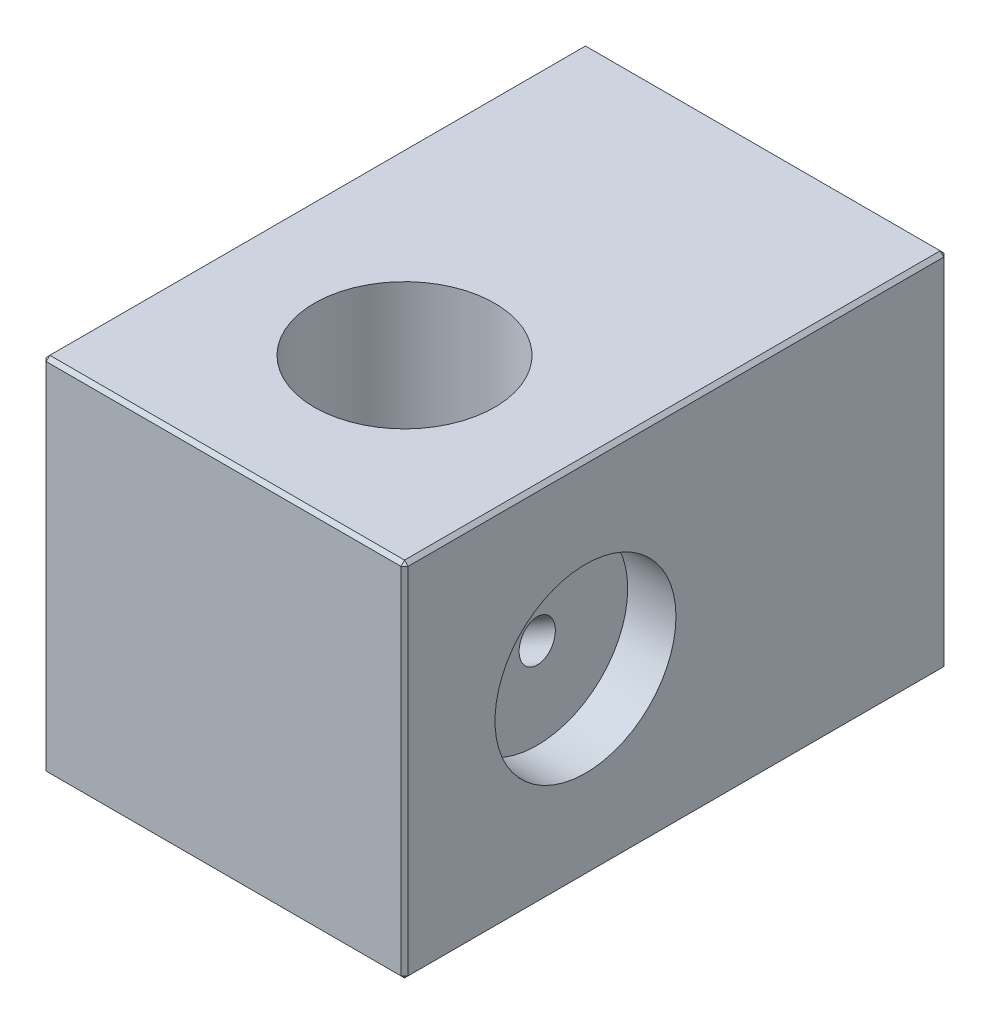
SolidWorks part; units mm, degrees
ref_plane "Přední rovina" through (0, 0, 0) normal (0, 0, 1) x (1, 0, 0)
ref_plane "Horní rovina" through (0, 0, 0) normal (0, 1, 0) x (1, 0, 0)
ref_plane "Pravá rovina" through (0, 0, 0) normal (1, 0, 0) x (0, 0, -1)
sketch "Skica1" plane through (0, 0, 0) normal (0, 1, 0) x (1, 0, 0)
  line L1 (-15, 0) -> (15, 0)
  line L2 (-15, 0) -> (-15, 45)
  line L3 (-15, 45) -> (15, 45)
  line L4 (15, 0) -> (15, 45)
  dimension "D1" = 30
  dimension "D2" = 45
  dimension "D3" = 15
extrude "Přidat vysunutím1" add sketch "Skica1" along normal blind 30
chamfer "Zkosení1" distance 0.3 angle 45 12 edges at (15, 15, 0) (-15, 15, 0) (0, 0, 0) (-15, 0, -22.5) (-15, 15, -45) (0, 0, -45) (15, 0, -22.5) (15, 15, -45) (0, 30, -45) (-15, 30, -22.5) (15, 30, -22.5) (0, 30, 0)
sketch "Skica2" plane through (0, 30, 0) normal (0, 1, 0) x (1, 0, 0)
  line L0 (14.7, 0) -> (-14.7, 0) construction
  circle A0 centre (0, 15) radius 7.475
  point P2 (0, 0)
  dimension "D1" = 14.95
  dimension "D2" = 15
extrude "Odebrat vysunutím1" cut sketch "Skica2" against normal blind 12
sketch "Skica3" plane through (0, 18, 0) normal (0, 1, 0) x (1, 0, 0)
  circle A0 centre (0, 15) radius 6.25
  circle A1 centre (0, 15) radius 7.475 construction
  dimension "D1" = 12.5
  dimension "D2" = 0
extrude "Odebrat vysunutím2" cut sketch "Skica3" against normal blind 3
hole_wizard "Ø3.5 (3.5) průměr díry1" positions "Skica5" profile "Skica4" hole size "Ø3.5" standard "ISO"
sketch "Skica5" plane through (0, 15, 0) normal (0, 1, 0) x (-1, 0, 0)
  circle A0 centre (0, -15) radius 6.25 construction
  point P0 (0, -15)
  dimension "D1" = 0
sketch "Skica4" plane through (0, 15, -15) normal (1, 0, 0) x (0, 0, 1)
  line L0 (0, 0) -> (0, 11.0104)
  line L1 (0, 11.0104) -> (1.75, 10)
  line L2 (1.75, 10) -> (1.75, 0)
  line L5 (1.75, 0) -> (0, 0)
  line L10 (0, 11.0104) -> (-1.75, 10) construction
  line L11 (0, -6.35) -> (0, 107.95) construction
  dimension "Průměr díry" = 3.5
  dimension "Hloubka díry" = 10
  dimension "Úhel vrtání" = 120
sketch "Skica6" plane through (15, 0, 0) normal (1, 0, 0) x (0, 0, -1)
  line L0 (0.3, 30) -> (44.7, 30) construction
  line L1 (0, 0.3) -> (0, 29.7) construction
  circle A0 centre (15, 15) radius 7.5
  dimension "D1" = 15
  dimension "D2" = 15
  dimension "D3" = 15
extrude "Odebrat vysunutím3" cut sketch "Skica6" against normal blind 4
sketch "Skica7" plane through (11, 0, 0) normal (1, 0, 0) x (0, 0, -1)
  line L1 (12.4479, 13.2) -> (17.4479, 13.2) construction
sketch3d "3DSkica2" plane through (0, 0, 0) normal (0, 0, 1) x (1, 0, 0)
  dimension "D1" = 150
sketch "Skica8" plane through (13.9658, 8.0631, 0) normal (-0.866, -0.5, 0) x (0, 0, 1)
  circle A0 centre (-15, 7.4904) radius 1.5
  ellipse E1 centre (-15, 7.4904) end of major axis (-22.5, 7.4904) minor radius 6.4952 construction
  dimension "D1" = 3
  dimension "D2" = 0
extrude "Odebrat vysunutím4" cut sketch "Skica8" along normal blind 12 and the other way blind 4
sketch "Skica9" plane through (-15, 0, 0) normal (-1, 0, 0) x (0, 0, 1)
  line L0 (0, 29.7) -> (0, 0.3) construction
  line L1 (-44.7, 30) -> (-0.3, 30) construction
  circle A0 centre (-15, 15) radius 7.5
  dimension "D1" = 15
  dimension "D2" = 15
  dimension "D3" = 15
extrude "Odebrat vysunutím5" cut sketch "Skica9" against normal blind 4
hole_wizard "Ø3.0 (3) průměr díry1" positions "Skica11" profile "Skica10" hole size "Ø3.0" standard "ISO"
sketch "Skica11" plane through (-11, 0, 0) normal (-1, 0, 0) x (0, 0, 1)
  circle A0 centre (-15, 15) radius 7.5 construction
  point P0 (-15, 15)
  dimension "D1" = 0
sketch "Skica10" plane through (-11, 15, -15) normal (0, 1, 0) x (0, 0, 1)
  line L0 (0, 0) -> (0, 7.866)
  line L1 (0, 7.866) -> (1.5, 7)
  line L2 (1.5, 7) -> (1.5, 0)
  line L5 (1.5, 0) -> (0, 0)
  line L10 (0, 7.866) -> (-1.5, 7) construction
  line L11 (0, -6.35) -> (0, 107.95) construction
  dimension "Průměr díry" = 3
  dimension "Hloubka díry" = 7
  dimension "Úhel vrtání" = 120
hole_wizard "Ø3.0 (3) průměr díry2" positions "Skica13" profile "Skica12" hole size "Ø3.0" standard "ISO"
sketch "Skica13" plane through (0, 0, -45) normal (0, 0, -1) x (-1, 0, 0)
  line L0 (-14.7, 30) -> (14.7, 30) construction
  line L1 (15, 29.7) -> (15, 0.3) construction
  point P0 (0, 15)
  dimension "D1" = 15
  dimension "D2" = 15
sketch "Skica12" plane through (0, 15, -45) normal (1, 0, 0) x (0, 1, 0)
  line L0 (0, 0) -> (0, 26.866)
  line L1 (0, 26.866) -> (1.5, 26)
  line L2 (1.5, 26) -> (1.5, 0)
  line L5 (1.5, 0) -> (0, 0)
  line L10 (0, 26.866) -> (-1.5, 26) construction
  line L11 (0, -6.35) -> (0, 107.95) construction
  dimension "Průměr díry" = 3
  dimension "Hloubka díry" = 26
  dimension "Úhel vrtání" = 120
hole_wizard "G1/4 závit1" positions "Skica15" profile "Skica14" tap size "G1/4" standard "AS"
sketch "Skica15" plane through (0, 0, -45) normal (0, 0, -1) x (-1, 0, 0)
  circle A0 centre (0, 15) radius 1.5 construction
  point P0 (0, 15)
  dimension "D1" = 0
sketch "Skica14" plane through (0, 15, -45) normal (1, 0, 0) x (0, 1, 0)
  line L0 (0, 0) -> (0, 18.4064)
  line L1 (0, 18.4064) -> (5.9, 15)
  line L2 (5.9, 15) -> (5.9, 0)
  line L5 (5.9, 0) -> (0, 0)
  line L10 (0, 18.4064) -> (-5.9, 15) construction
  line L11 (0, -6.35) -> (0, 107.95) construction
  dimension "Průměr závitníku" = 11.8
  dimension "Hloubka závitníku" = 15
  dimension "Úhel vrtání" = 120
